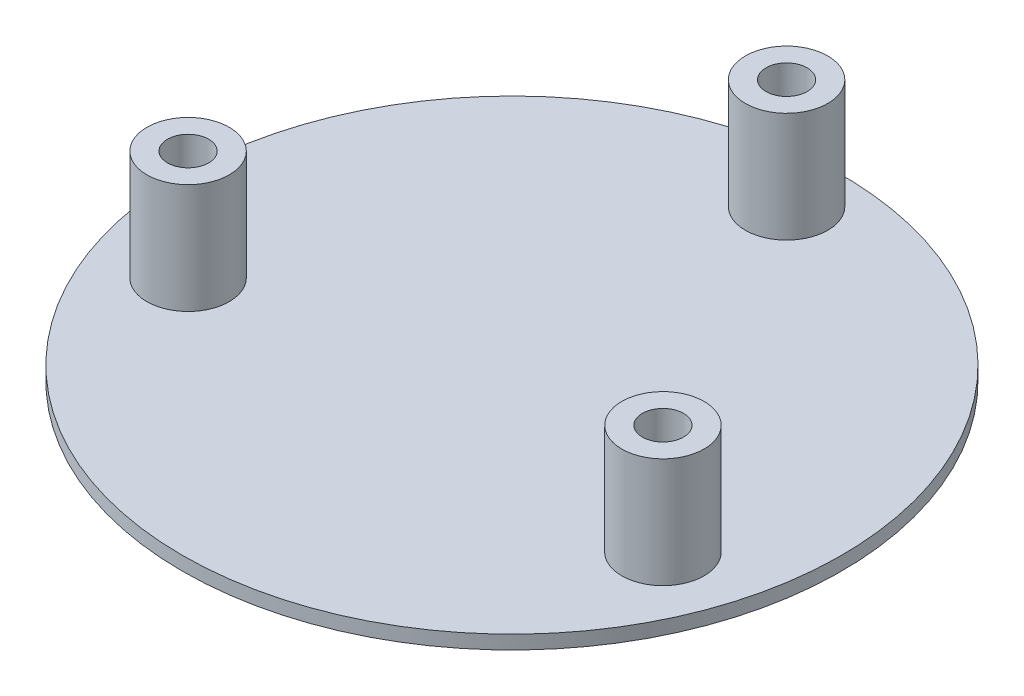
SolidWorks part; units mm, degrees
ref_plane "Front Plane" through (0, 0, 0) normal (0, 0, 1) x (1, 0, 0)
ref_plane "Top Plane" through (0, 0, 0) normal (0, 1, 0) x (1, 0, 0)
ref_plane "Right Plane" through (0, 0, 0) normal (1, 0, 0) x (0, 0, -1)
sketch "Sketch1" plane through (0, 0, 0) normal (0, 1, 0) x (1, 0, 0)
  circle A0 centre (0, 0) radius 76.2
  dimension "D1" = 152.4
extrude "Boss-Extrude1" add sketch "Sketch1" along normal blind 3.175
sketch "Sketch2" plane through (0, 3.175, 0) normal (0, 1, 0) x (1, 0, 0)
  line L0 (0, 0) -> (0, 63.5) construction
  line L1 (0, 0) -> (54.8968, -19.9808) construction
  line L2 (0, 0) -> (-54.8968, -19.9808) construction
  circle A0 centre (0, 63.5) radius 9.525
  circle A1 centre (-54.8968, -19.9808) radius 9.525
  circle A2 centre (54.8968, -19.9808) radius 9.525
  circle A3 centre (0, 63.5) radius 4.7625
  circle A4 centre (-54.8968, -19.9808) radius 4.7625
  circle A5 centre (54.8968, -19.9808) radius 4.7625
  dimension "D1" = 19.05
  dimension "D2" = 9.525
  dimension "D3" = 63.5
  dimension "D4" = 110
  dimension "D5" = 58.42
  dimension "D6" = 110
  dimension "D7" = 58.42
extrude "Boss-Extrude2" add sketch "Sketch2" along normal blind 25.4
